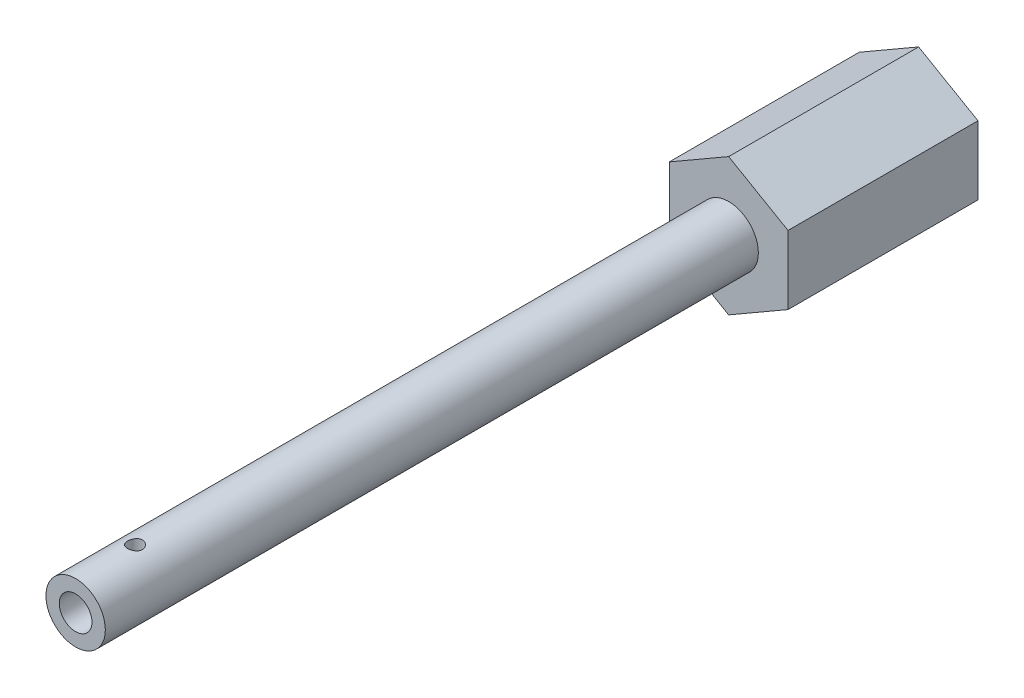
SolidWorks part; units mm, degrees
ref_plane "Front Plane" through (0, 0, 0) normal (0, 0, 1) x (1, 0, 0)
ref_plane "Top Plane" through (0, 0, 0) normal (0, 1, 0) x (1, 0, 0)
ref_plane "Right Plane" through (0, 0, 0) normal (1, 0, 0) x (0, 0, -1)
sketch "Sketch1" plane through (0, 0, 0) normal (0, 0, 1) x (1, 0, 0)
  line L1 (0, 7.3323) -> (-6.35, 3.6662)
  line L2 (-6.35, 3.6662) -> (-6.35, -3.6662)
  line L3 (-6.35, -3.6662) -> (0, -7.3323)
  line L4 (0, -7.3323) -> (6.35, -3.6662)
  line L5 (6.35, -3.6662) -> (6.35, 3.6662)
  line L6 (6.35, 3.6662) -> (0, 7.3323)
  circle A0 centre (0, 0) radius 6.35 construction
  dimension "D1" = 12.7
extrude "Boss-Extrude1" add sketch "Sketch1" along normal blind 20.32 contours L6 L1 L2 L3 L4 L5
sketch "Sketch2" plane through (0, 0, 20.32) normal (0, 0, 1) x (1, 0, 0)
  circle A0 centre (0, 0) radius 3.175
  dimension "D1" = 6.35
extrude "Boss-Extrude2" add sketch "Sketch2" along normal blind 69.85
hole_wizard "Ø3.5 (3.5) Diameter Hole1" positions "Sketch3" profile "Sketch4" hole size "Ø3.5" standard "ANSI Metric"
sketch "Sketch3" plane through (0, 0, 90.17) normal (0, 0, 1) x (1, 0, 0)
  point P0 (0, 0)
sketch "Sketch4" plane through (0, 0, 90.17) normal (1, 0, 0) x (0, -1, 0)
  line L0 (0, 0) -> (0, 26.4515)
  line L1 (0, 26.4515) -> (1.75, 25.4)
  line L2 (1.75, 25.4) -> (1.75, 0)
  line L5 (1.75, 0) -> (0, 0)
  line L10 (0, 26.4515) -> (-1.75, 25.4) construction
  line L11 (0, -6.35) -> (0, 107.95) construction
  dimension "Hole Dia." = 3.5
  dimension "Hole Depth" = 25.4
  dimension "Drill Angle" = 118
ref_plane "Plane1" through (0, 7.62, 0) normal (0, 1, 0) x (1, 0, 0)
hole_wizard "1/16 (0.0625) Diameter Hole1" positions "Sketch5" profile "Sketch6" hole size "1/16" standard "ANSI Inch"
sketch "Sketch5" plane through (0, 7.62, 0) normal (0, 1, 0) x (1, 0, 0)
  line L0 (-3.175, -90.17) -> (3.175, -90.17) construction
  point P0 (0, -83.82)
  dimension "D1" = 6.35
sketch "Sketch6" plane through (0, 7.62, 83.82) normal (1, 0, 0) x (0, 0, 1)
  line L0 (0, 0) -> (0, 14.9523)
  line L1 (0, 14.9523) -> (0.7937, 14.9523)
  line L2 (0.7937, 14.9523) -> (0.7937, 0)
  line L5 (0.7937, 0) -> (0, 0)
  line L11 (0, -6.35) -> (0, 107.95) construction
  dimension "Thru Hole Dia." = 1.5875
  dimension "Thru Hole Depth" = 14.9523
